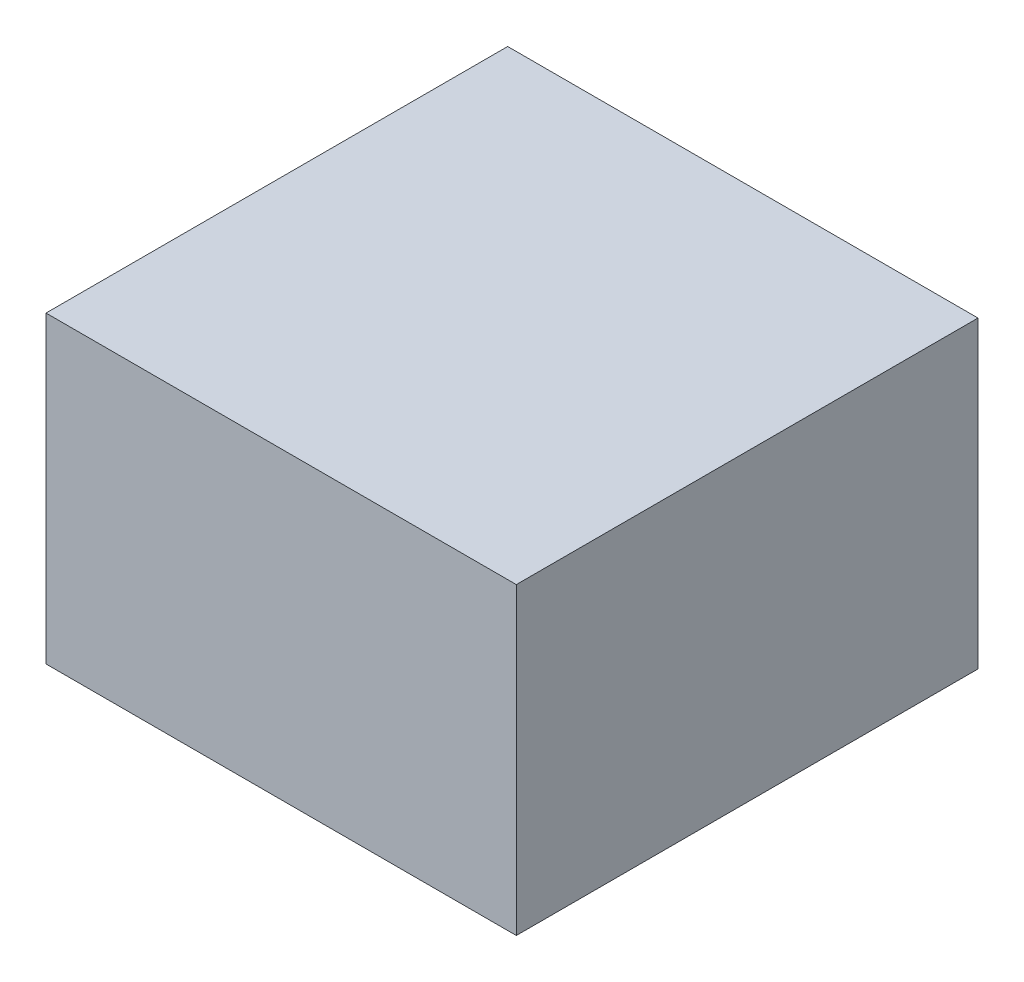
SolidWorks part; units mm, degrees
ref_plane "Front" through (0, 0, 0) normal (0, 0, 1) x (1, 0, 0)
ref_plane "Top" through (0, 0, 0) normal (0, 1, 0) x (1, 0, 0)
ref_plane "Right" through (0, 0, 0) normal (1, 0, 0) x (0, 0, -1)
sketch "Sketch1"
extrude "Extrude1" add sketch "Sketch1" along normal blind 66.04
